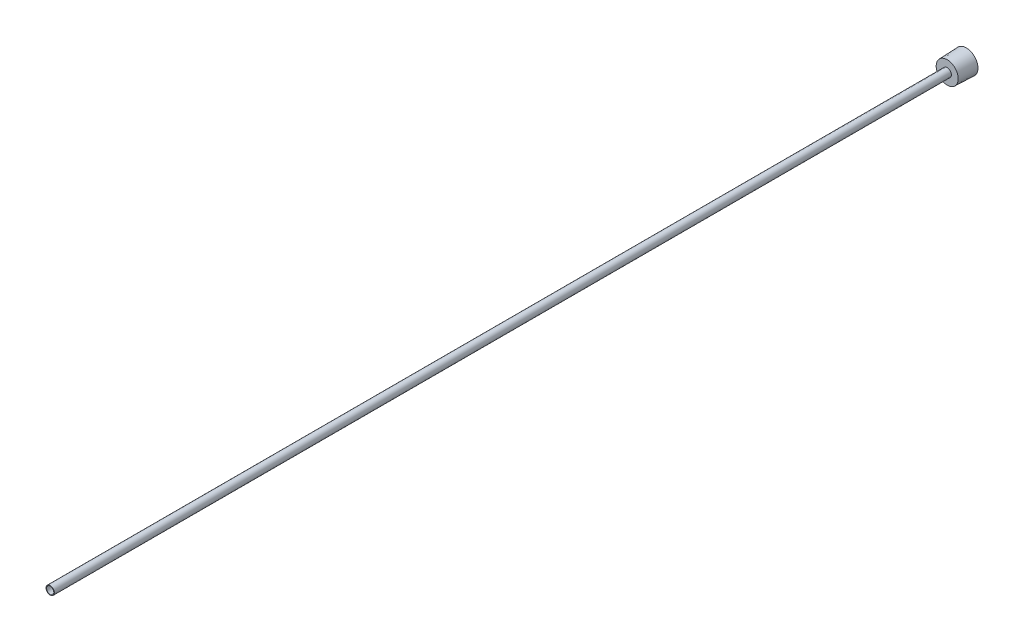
SolidWorks part; units mm, degrees
ref_plane "Front Plane" through (0, 0, 0) normal (0, 0, 1) x (1, 0, 0)
ref_plane "Top Plane" through (0, 0, 0) normal (0, 1, 0) x (1, 0, 0)
ref_plane "Right Plane" through (0, 0, 0) normal (1, 0, 0) x (0, 0, -1)
sketch "Sketch1" plane through (0, 0, 0) normal (1, 0, 0) x (0, 0, -1)
  line L0 (-304.8, 0) -> (0, 0)
  line L5 (0, 3.8989) -> (-6.35, 3.6674)
  line L6 (0, 0) -> (0, 3.8989)
  line L7 (-6.35, 3.6674) -> (-6.35, 1.3891)
  line L8 (-6.35, 1.3891) -> (-304.8, 1.3891)
  line L9 (-304.8, 1.3891) -> (-304.8, 0)
  line L10 (0, 0) -> (49989.3417, 0) construction
  dimension "D1" = 2.088
  dimension "D2" = 6.35
  dimension "D3" = 304.8
  dimension "D4" = 2.7781
  dimension "D5" = 7.7978
revolve "Revolve1" add sketch "Sketch1" angle 360 about L10
sketch "Sketch2" plane through (0, 0, 304.8) normal (0, 0, 1) x (1, 0, 0)
  circle A0 centre (0, 0) radius 1.2065
  dimension "D1" = 2.413
extrude "Cut-Extrude1" cut sketch "Sketch2" against normal through all
sketch "Sketch3" plane through (0, 0, 0) normal (0, 0, -1) x (-1, 0, 0)
  line L0 (0, 4.2888) -> (0, -4.2888) construction
  line L1 (0, -2.757) -> (2.3876, -1.3785)
  line L2 (2.3876, -1.3785) -> (2.3876, 1.3785)
  line L3 (2.3876, 1.3785) -> (0, 2.757)
  line L4 (0, 2.757) -> (-2.3876, 1.3785)
  line L5 (-2.3876, 1.3785) -> (-2.3876, -1.3785)
  line L6 (-2.3876, -1.3785) -> (0, -2.757)
  circle A0 centre (0, 0) radius 2.3876 construction
  dimension "D1" = 4.7752
extrude "Cut-Extrude2" cut sketch "Sketch3" against normal blind 3.9688
